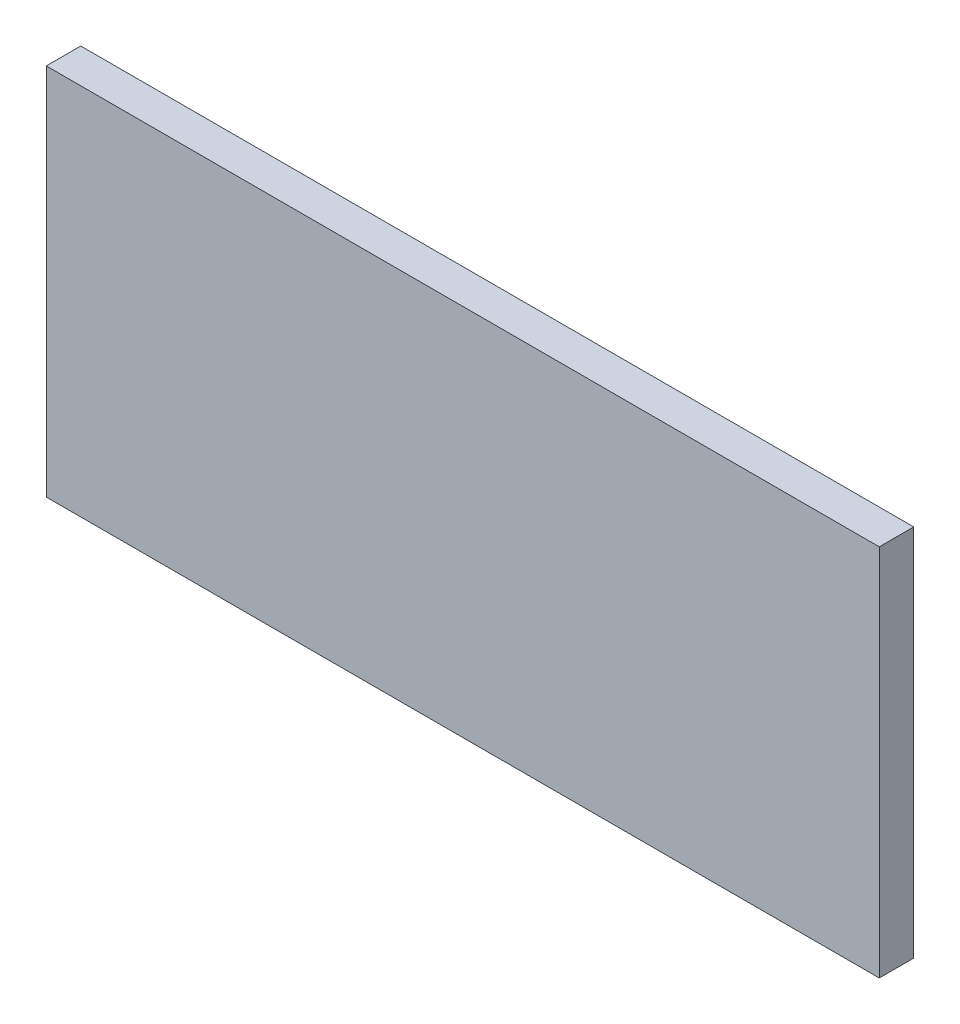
SolidWorks part; units mm, degrees
ref_plane "Plan de face" through (0, 0, 0) normal (0, 0, 1) x (1, 0, 0)
ref_plane "Plan de dessus" through (0, 0, 0) normal (0, 1, 0) x (1, 0, 0)
ref_plane "Plan de droite" through (0, 0, 0) normal (1, 0, 0) x (0, 0, -1)
sketch "Esquisse1" plane through (0, 0, 0) normal (0, 0, 1) x (1, 0, 0)
  line L1 (0, 0) -> (290, 0)
  line L2 (0, 0) -> (0, 130)
  line L3 (0, 130) -> (290, 130)
  line L4 (290, 0) -> (290, 130)
  dimension "D1" = 130
  dimension "D2" = 290
extrude "Extrusion1" add sketch "Esquisse1" along normal blind 12
